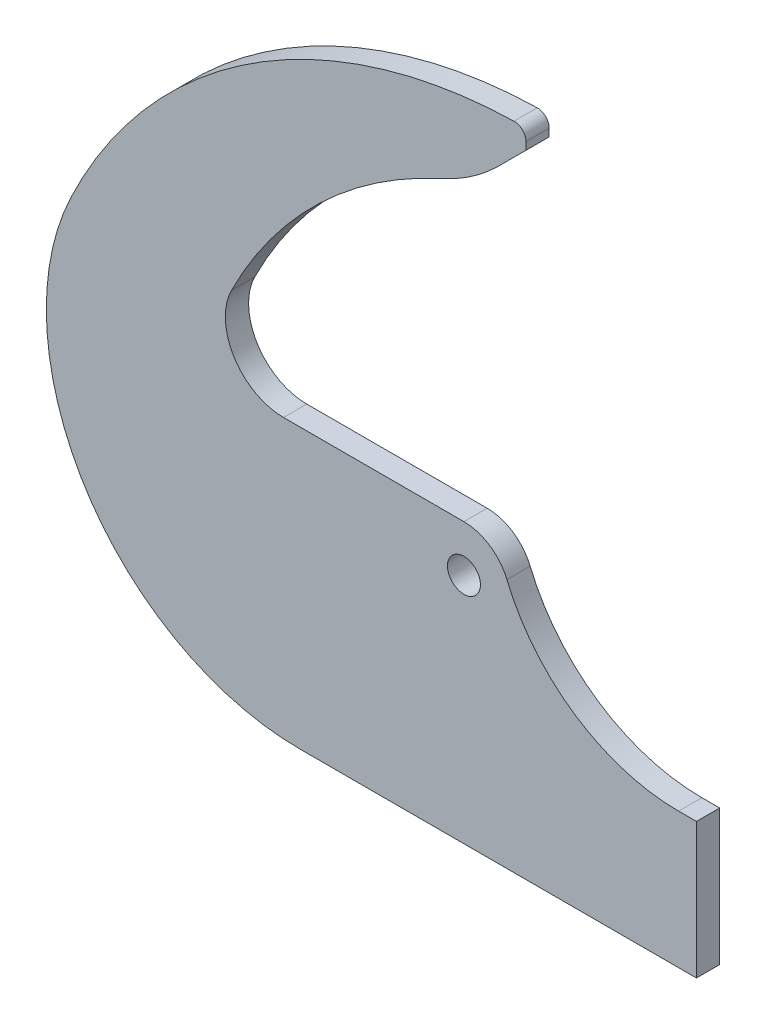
SolidWorks part; units mm, degrees
ref_plane "Přední" through (0, 0, 0) normal (0, 0, 1) x (1, 0, 0)
ref_plane "Horní" through (0, 0, 0) normal (0, 1, 0) x (1, 0, 0)
ref_plane "Pravá" through (0, 0, 0) normal (1, 0, 0) x (0, 0, -1)
sketch "Skica1" plane through (0, 0, 0) normal (0, 0, 1) x (1, 0, 0)
  line L0 (60, -36) -> (0, -36)
  line L1 (0, -60) -> (60, -60)
  line L2 (60, -60) -> (60, -36)
  arc A0 (0, -36) -> (-3.9579, 39.7933) centre (0, 2) cw
  arc A1 (-3.9579, 39.7933) -> (-6.0006, 59.6992) centre (-5, 49.7441) ccw
  arc A2 (-6.0006, 59.6992) -> (0, -60) centre (0, 0) ccw
  dimension "D2" = 38
  dimension "D5" = 60
  dimension "D1" = 60
  dimension "D3" = 5
  dimension "D4" = 2
sheet metal parameters "Plechový díl1" thickness 6 parameters "D1"=3
base flange "Základní plech1" sketch "Skica1" thickness 6 reverse thickness direction yes parameters "D1"=3
sketch "Skica2" plane through (0, 0, 6) normal (0, 0, 1) x (1, 0, 0)
  line L0 (25, -36) -> (11.3538, 3.8846)
  line L1 (-12, 0) -> (-12, -36)
  line L2 (60, -36) -> (0, -36) construction
  line L3 (25, -36) -> (-12, -36)
  line L4 (60, -60) -> (60, -36) construction
  arc A0 (11.3538, 3.8846) -> (-12, 0) centre (0, 0) ccw
  dimension "D1" = 12
  dimension "D2" = 35
base flange "Ouško1" sketch "Skica2" thickness 6 reverse thickness direction yes parameters "D1"=3
hole_wizard "M10x1.5 závitové díry1" positions "Skica4" profile "Skica3" tap size "M10x1.5" standard "ISO"
sketch "Skica4" plane through (0, 0, 6) normal (0, 0, 1) x (1, 0, 0)
  point P0 (0, 0)
sketch "Skica3" plane through (0, 0, 6) normal (1, 0, 0) x (0, -1, 0)
  line L0 (0, 0) -> (0, 30.0537)
  line L1 (0, 30.0537) -> (4.25, 27.5)
  line L2 (4.25, 27.5) -> (4.25, 0)
  line L5 (4.25, 0) -> (0, 0)
  line L10 (0, 30.0537) -> (-4.25, 27.5) construction
  line L11 (0, -6.35) -> (0, 107.95) construction
  dimension "Prùmìr závitníku" = 8.5
  dimension "Hloubka závitníku" = 27.5
  dimension "Úhel vrtání" = 118
sketch "Skica5" plane through (0, 0, 6) normal (0, 0, 1) x (1, 0, 0)
  line L0 (-6, 10.3923) -> (-44.0158, -11.5561)
  line L1 (-44.0158, -11.5561) -> (-15.0579, -42.892)
  line L2 (-15.0579, -42.892) -> (-7.5379, -42.892)
  line L3 (-7.5379, -42.892) -> (-7.5379, 1.6107)
  line L4 (-7.5379, 1.6107) -> (-6, 10.3923)
  line L5 (60, -36) -> (25, -36) construction
  arc A0 (11.3538, 3.8846) -> (-12, 0) centre (0, 0) ccw construction
  dimension "D1" = 30
base flange "Ouško2" sketch "Skica5" thickness 6 reverse thickness direction yes parameters "D1"=3
fillet "Zaoblit3" radius 12 1 edges at (-36.8188, -7.4009, 3)
sketch "Skica7" plane through (0, 0, 6) normal (0, 0, 1) x (1, 0, 0)
  line L0 (-18, 35.4664) -> (8.5355, 49.7386)
  line L1 (8.5355, 49.7386) -> (16.2119, 35.4664)
  line L2 (16.2119, 35.4664) -> (-18, 35.4664)
  arc A0 (-3.9579, 39.7933) -> (-33.2608, 20.3771) centre (0, 2) ccw construction
  dimension "D1" = 18
extrude "Odebrat vysunutím1" cut sketch "Skica7" against normal blind 18.2
fillet "Zaoblit4" radius 7 1 edges at (4.8003, 47.7296, 3)
sketch "Skica8" plane through (0, 0, 0) normal (0, 0, -1) x (-1, 0, 0)
  line L0 (0, -60) -> (-60, -60) construction
  line L1 (-60, -36) -> (-21.2365, -36)
  line L2 (-60, -36) -> (-60, -25)
  line L3 (-60, -25) -> (-21.2365, -25)
  line L4 (-21.2365, -36) -> (-21.2365, -25)
  line L5 (-25, -36) -> (-11.3538, 3.8846) construction
  dimension "D1" = 35
base flange "Ouško3" sketch "Skica8" thickness 6 reverse thickness direction yes parameters "D1"=3
fillet "Zaoblit2" radius 48 1 edges at (21.2365, -25, 3)
sketch "Skica12" plane through (0, 0, 6) normal (0, 0, 1) x (1, 0, 0)
  line L0 (-46.5818, 12) -> (0, 12)
  line L1 (16, 108) -> (58.0242, 108) construction
  line L3 (0, -60) -> (-42.1912, -60)
  line L4 (0, 12) -> (-22.4503, -10.7345)
  line L5 (-22.4503, -10.7345) -> (0, -60)
  line L6 (16, 108) -> (16, 93)
  arc A0 (16, 93) -> (-60, 33.7046) centre (40.1891, -16.3567) ccw
  arc A1 (11.0833, 4.6) -> (-6, 10.3923) centre (0, 0) ccw construction
  arc A2 (-60, 33.7046) -> (-46.5818, 12) centre (-46.5818, 27) ccw
  arc A3 (16, 108) -> (-101.4606, 33.7046) centre (16, -22) ccw
  arc A4 (-101.4606, 33.7046) -> (-42.1912, -60) centre (-42.1912, 5.5967) ccw
  dimension "D3" = 112
  dimension "D6" = 15
  dimension "D8" = 130
  dimension "D1" = 16
  dimension "D2" = 93
  dimension "D5" = 60
  dimension "D7" = 15
base flange "Ouško5" sketch "Skica12" thickness 6 reverse thickness direction yes parameters "D1"=3
sketch "Skica13" plane through (0, 0, 6) normal (0, 0, 1) x (1, 0, 0)
  line L0 (0, 12) -> (-34.4781, 12) construction
  line L1 (0, 12) -> (-46.5818, 12)
  line L2 (16, 93) -> (11.0833, 4.6)
  arc A0 (-60, 33.7046) -> (-57.5952, 16.8164) centre (-46.5818, 27) ccw construction
  arc A1 (-60, 33.7046) -> (-46.5818, 12) centre (-46.5818, 27) ccw
  arc A2 (11.0833, 4.6) -> (0, 12) centre (0, 0) ccw construction
  arc A3 (16, 93) -> (-60, 33.7046) centre (40.1891, -16.3567) ccw construction
  arc A4 (11.0833, 4.6) -> (0, 12) centre (0, 0) ccw
  arc A5 (16, 93) -> (-60, 33.7046) centre (40.1891, -16.3567) ccw
extrude "Odebrat vysunutím4" cut sketch "Skica13" against normal blind 10
chamfer "Zkosit1" distance 10 angle 45 1 edges at (16, 93, 3)
fillet "Zaoblit5" radius 3 1 edges at (16, 108, 3)
fillet "Zaoblit6" radius 50 1 edges at (1.8923, 88.8923, 3)
flat pattern "Rozvinutý tvar1"
sketch "Čáry ohybu1" plane through (0, 0, 0) normal (0, 1, 0) x (-1, 0, 0)
sketch3d "Bounding-Box1" [suppressed]
  line L0 (13.0509, 112.2004, 0) -> (70.599, -58.4252, 0) construction
  line L1 (-131.5937, 63.415, 0) -> (-74.0457, -107.2105, 0) construction
  line L2 (13.0509, 112.2004, 0) -> (-131.5937, 63.415, 0) construction
  line L3 (70.599, -58.4252, 0) -> (-74.0457, -107.2105, 0) construction
sketch "Skica10" [suppressed] plane through (0, 0, 6) normal (0, 0, 1) x (1, 0, 0)
  line L1 (60, -60) -> (-107.7879, -60)
  line L2 (60, -60) -> (60, 107.9646)
  line L3 (60, 107.9646) -> (-107.7879, 107.9646)
  line L4 (-107.7879, -60) -> (-107.7879, 107.9646)
  arc A0 (-101.4606, 33.7046) -> (-42.1912, -60) centre (-42.1912, 5.5967) ccw construction
  arc A1 (16, 104.9646) -> (12.9291, 107.9637) centre (13, 104.9646) ccw construction
  dimension "D2" = 167.7879
  dimension "D1" = 167.9646
